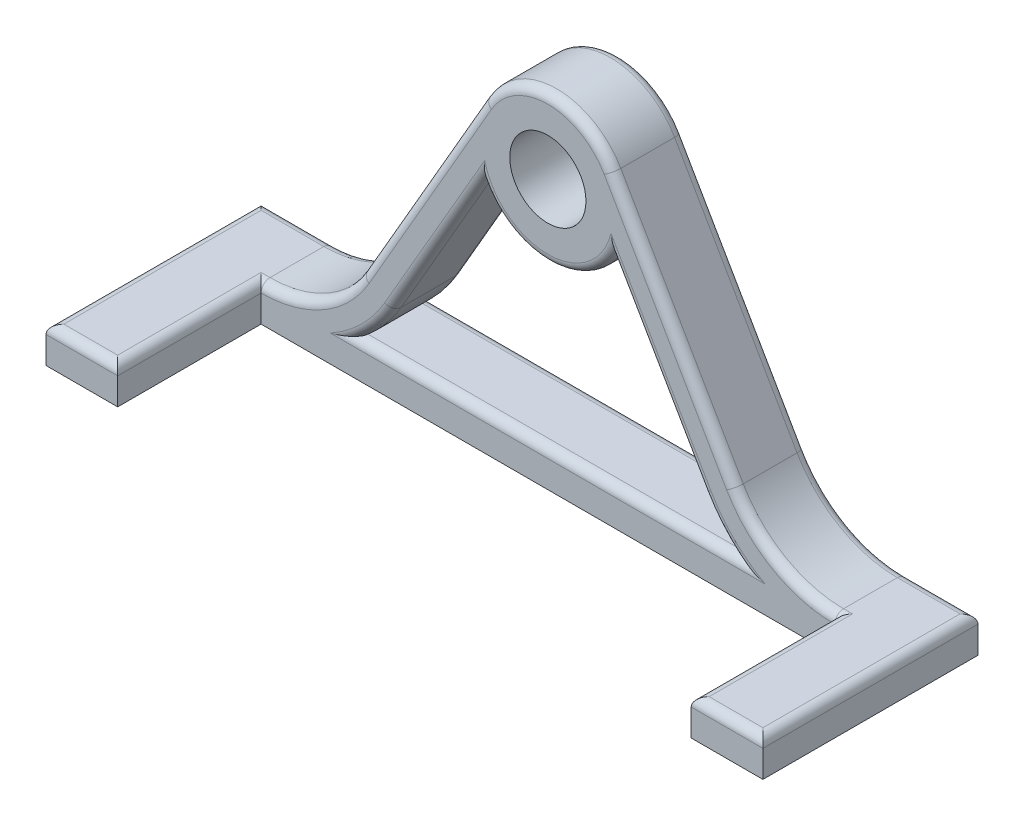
SolidWorks part; units mm, degrees
ref_plane "Front" through (0, 0, 0) normal (0, 0, 1) x (1, 0, 0)
ref_plane "Top" through (0, 0, 0) normal (0, 1, 0) x (1, 0, 0)
ref_plane "Right" through (0, 0, 0) normal (1, 0, 0) x (0, 0, -1)
sketch "Sketch1" plane through (0, 0, 0) normal (0, 0, 1) x (1, 0, 0)
  line L0 (-63.5, 0) -> (63.5, 0)
  line L1 (11.3422, 54.1734) -> (33.0297, 16.6097)
  line L2 (-11.3422, 54.1734) -> (-33.0297, 16.6097)
  line L3 (50.8, 6.35) -> (63.5, 6.35)
  line L4 (0, 0) -> (0, 60.7219) construction
  line L5 (-50.8, 6.35) -> (-63.5, 6.35)
  line L6 (63.5, 6.35) -> (63.5, 0)
  line L7 (-63.5, 6.35) -> (-63.5, 0)
  circle A0 centre (0, 47.625) radius 6.7469
  arc A1 (-11.3422, 54.1734) -> (11.3422, 54.1734) centre (0, 47.625) cw
  arc A2 (33.0297, 16.6097) -> (50.8, 6.35) centre (50.8, 26.8694) ccw
  arc A3 (-33.0297, 16.6097) -> (-50.8, 6.35) centre (-50.8, 26.8694) cw
  dimension "D3" = 13.4937
  dimension "D2" = 127
  dimension "D1" = 6.35
  dimension "D7" = 12.7
  dimension "D4" = 47.625
  dimension "D5" = 60
  dimension "D6" = 6.35
extrude "Base-Extrude" add sketch "Sketch1" along normal blind 12.7
sketch "Sketch5" plane through (0, 0, 12.7) normal (0, 0, 1) x (1, 0, 0)
  line L7 (-33.453, 6.35) -> (33.453, 6.35)
  line L8 (27.5304, 13.4347) -> (5.843, 50.9984)
  line L9 (-5.843, 50.9984) -> (-27.5304, 13.4347)
  line L10 (-33.453, 6.35) -> (33.453, 6.35)
  line L11 (27.5304, 13.4347) -> (11.4556, 41.277)
  line L12 (-11.4556, 41.277) -> (-27.5304, 13.4347)
  circle A1 centre (0, 47.625) radius 13.0969
  arc A2 (-11.4556, 41.277) -> (11.4556, 41.277) centre (0, 47.625) ccw
  arc A5 (27.5304, 13.4347) -> (33.453, 6.35) centre (50.8, 26.8694) ccw
  arc A6 (5.843, 50.9984) -> (-5.843, 50.9984) centre (0, 47.625) ccw
  arc A7 (-33.453, 6.35) -> (-27.5304, 13.4347) centre (-50.8, 26.8694) ccw
  arc A8 (27.5304, 13.4347) -> (33.453, 6.35) centre (50.8, 26.8694) ccw
  arc A10 (-33.453, 6.35) -> (-27.5304, 13.4347) centre (-50.8, 26.8694) ccw
  dimension "D1" = 6.35
  dimension "D2" = 6.35
extrude "Cut-Extrude3" cut sketch "Sketch5" against normal through all
sketch "Sketch7" plane through (0, 0, 0) normal (0, -1, 0) x (1, 0, 0)
  line L0 (63.5, 0) -> (50.8, 0)
  line L1 (63.5, 0) -> (63.5, 38.1)
  line L2 (50.8, 38.1) -> (63.5, 38.1)
  line L3 (50.8, 38.1) -> (50.8, 0)
  line L4 (50.8, 12.7) -> (50.8, 0) construction
  line L5 (-63.5, 0) -> (-50.8, 0)
  line L6 (-63.5, 0) -> (-63.5, 38.1)
  line L7 (-50.8, 38.1) -> (-63.5, 38.1)
  line L8 (-50.8, 38.1) -> (-50.8, 0)
  line L9 (-50.8, 12.7) -> (-50.8, 0) construction
  dimension "D1" = 38.1
extrude "Boss-Extrude1" add sketch "Sketch7" against normal blind 6.35
fillet "Fillet1" radius 1.5875 16 edges at (40.5403, 9.0991, 0) (57.15, 6.35, 0) (-63.5, 6.35, 19.05) (40.5403, 9.0991, 12.7) (63.5, 6.35, 19.05) (22.1859, 35.3916, 12.7) (0, 60.7219, 12.7) (-22.1859, 35.3916, 12.7) (-40.5403, 9.0991, 12.7) (57.15, 6.35, 38.1) (-57.15, 6.35, 38.1) (-57.15, 6.35, 0) (-40.5403, 9.0991, 0) (-22.1859, 35.3916, 0) (0, 60.7219, 0) (22.1859, 35.3916, 0)
fillet "Fillet2" radius 1.5875 12 edges at (0, 34.5281, 12.7) (19.493, 27.3559, 0) (30.1851, 9.636, 12.7) (0, 6.35, 0) (-30.1851, 9.636, 12.7) (-19.493, 27.3559, 0) (0, 34.5281, 0) (30.1851, 9.636, 0) (-30.1851, 9.636, 0) (-19.493, 27.3559, 12.7) (0, 6.35, 12.7) (19.493, 27.3559, 12.7)
